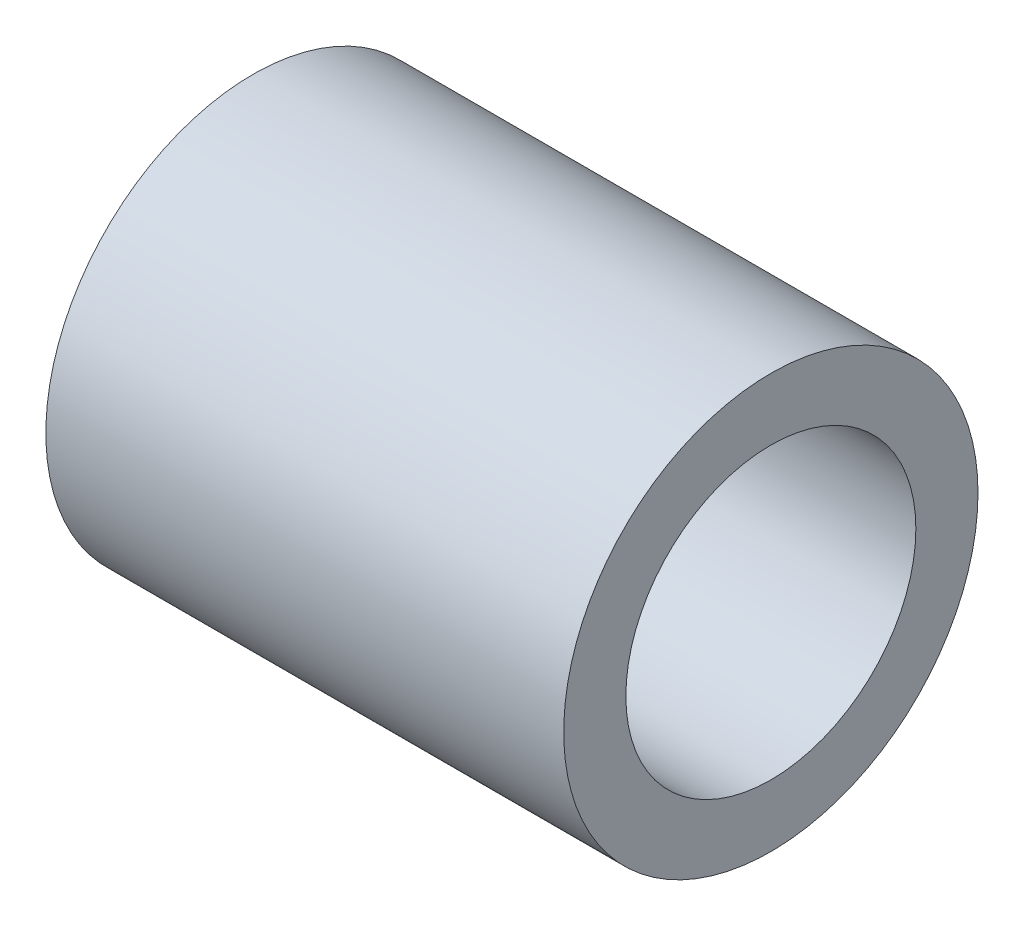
SolidWorks part; units mm, degrees
ref_plane "Ebene vorne" through (0, 0, 0) normal (0, 0, 1) x (1, 0, 0)
ref_plane "Ebene oben" through (0, 0, 0) normal (0, 1, 0) x (1, 0, 0)
ref_plane "Ebene rechts" through (0, 0, 0) normal (1, 0, 0) x (0, 0, -1)
sketch "Skizze1" plane through (0, 0, 0) normal (0, 1, 0) x (1, 0, 0)
  line L0 (0, 0) -> (-83.7739, 0) construction
  line L1 (0, 10) -> (-25, 10)
  line L2 (-25, 10) -> (-25, 4.25)
  line L3 (-25, 4.25) -> (-15, 4.25)
  line L4 (-15, 4.25) -> (-15, 7)
  line L5 (-15, 7) -> (0, 7)
  line L6 (0, 7) -> (0, 10)
  dimension "D1" = 20
  dimension "D2" = 8.5
  dimension "D3" = 25
  dimension "D4" = 10
  dimension "D5" = 14
revolve "Rotation1" add sketch "Skizze1" angle 360 about L0
chamfer "Fase1" distance 0.5 angle 45 1 edges at (-15, 0, -4.25)
